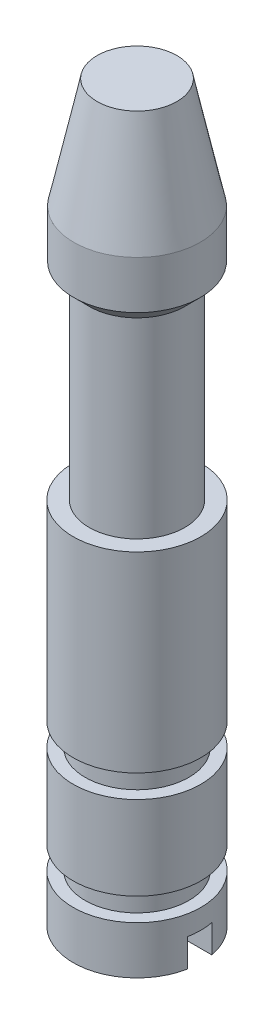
SolidWorks part; units mm, degrees
ref_plane "Front Plane" through (0, 0, 0) normal (0, 0, 1) x (1, 0, 0)
ref_plane "Top Plane" through (0, 0, 0) normal (0, 1, 0) x (1, 0, 0)
ref_plane "Right Plane" through (0, 0, 0) normal (1, 0, 0) x (0, 0, -1)
sketch "Sketch1" plane through (0, 0, 0) normal (0, 0, 1) x (1, 0, 0)
  line L0 (0, 36.5125) -> (1.9844, 36.5125)
  line L1 (1.9844, 36.5125) -> (3.1496, 31.0305)
  line L2 (3.1496, 31.0305) -> (3.1496, 28.6493)
  line L3 (3.1496, 28.6493) -> (2.3813, 27.8809)
  line L4 (2.3813, 27.8809) -> (2.3813, 18.3559)
  line L5 (2.3813, 18.3559) -> (3.175, 18.3559)
  line L6 (3.175, 18.3559) -> (3.175, 8.8309)
  line L7 (3.175, 8.8309) -> (2.5797, 8.8309)
  line L8 (2.5797, 8.8309) -> (2.5797, 7.6879)
  line L9 (3.175, 0) -> (0, 0)
  line L10 (0, 0) -> (0, 36.5125)
  line L11 (0, 36.5125) -> (0, 142.3692) construction
  line L12 (2.5797, 7.6879) -> (3.175, 7.6879)
  line L13 (3.175, 7.6879) -> (3.175, 3.5242)
  line L14 (3.175, 3.5242) -> (2.5797, 3.5242)
  line L15 (2.5797, 3.5242) -> (2.5797, 2.3813)
  line L16 (2.5797, 2.3813) -> (3.175, 2.3813)
  line L17 (3.175, 2.3813) -> (3.175, 0)
  dimension "D1" = 12
  dimension "D2" = 6.2992
  dimension "D3" = 3.9688
  dimension "D4" = 45
  dimension "D5" = 4.7625
  dimension "D6" = 2.3813
  dimension "D7" = 9.525
  dimension "D8" = 6.35
  dimension "D9" = 5.1594
  dimension "D10" = 1.143
  dimension "D11" = 2.3813
  dimension "D12" = 9.525
  dimension "D13" = 36.5125
revolve "Revolve1" add sketch "Sketch1" angle 360 about L11
sketch "Sketch2" plane through (0, 0, 0) normal (0, -1, 0) x (1, 0, 0)
  line L1 (-3.175, 0.6096) -> (3.175, 0.6096)
  line L2 (-3.175, 0.6096) -> (-3.175, -0.6096)
  line L3 (-3.175, -0.6096) -> (3.175, -0.6096)
  line L4 (3.175, 0.6096) -> (3.175, -0.6096)
  circle A0 centre (0, 0) radius 3.175 construction
  point P6 (-3.175, 0)
  dimension "D1" = 1.2192
extrude "Extrude1" cut sketch "Sketch2" against normal blind 1.397
